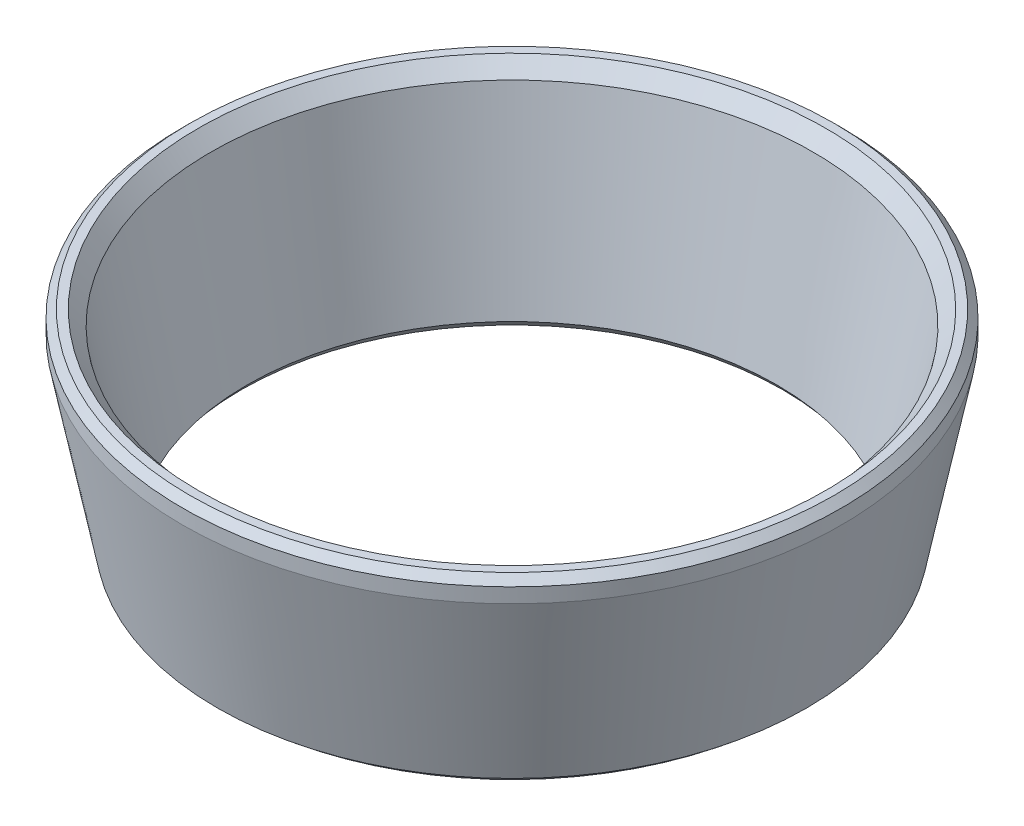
SolidWorks part; units mm, degrees
ref_plane "Front Plane" through (0, 0, 0) normal (0, 0, 1) x (1, 0, 0)
ref_plane "Top Plane" through (0, 0, 0) normal (0, 1, 0) x (1, 0, 0)
ref_plane "Right Plane" through (0, 0, 0) normal (1, 0, 0) x (0, 0, -1)
sketch "Sketch2" plane through (0, 0, 0) normal (0, 0, 1) x (1, 0, 0)
  line L0 (0, 0) -> (0, 24.2983) construction
  line L1 (20.758, 14) -> (22.5, 14)
  line L2 (22.5, 14) -> (22.5, 12.5)
  line L3 (20.0272, 0) -> (17.9884, 0)
  line L4 (17.9884, 0) -> (20.758, 14)
  line L5 (0, 0) -> (56.9231, 0) construction
  line L6 (20.0272, 0) -> (22.5, 12.5)
  dimension "D1" = 45
  dimension "D2" = 2
  dimension "D3" = 1.5
  dimension "D4" = 11.19
  dimension "D5" = 14
revolve "Revolve1" add sketch "Sketch2" angle 360 about L0
chamfer "Chamfer1" distance 1 angle 30 1 edges at (0, 14, -20.758)
chamfer "Chamfer2" distance 0.5 distance2 0.5 3 edges at (0, 0, -20.0272) (0, 0, -17.9884) (0, 14, -22.5)
